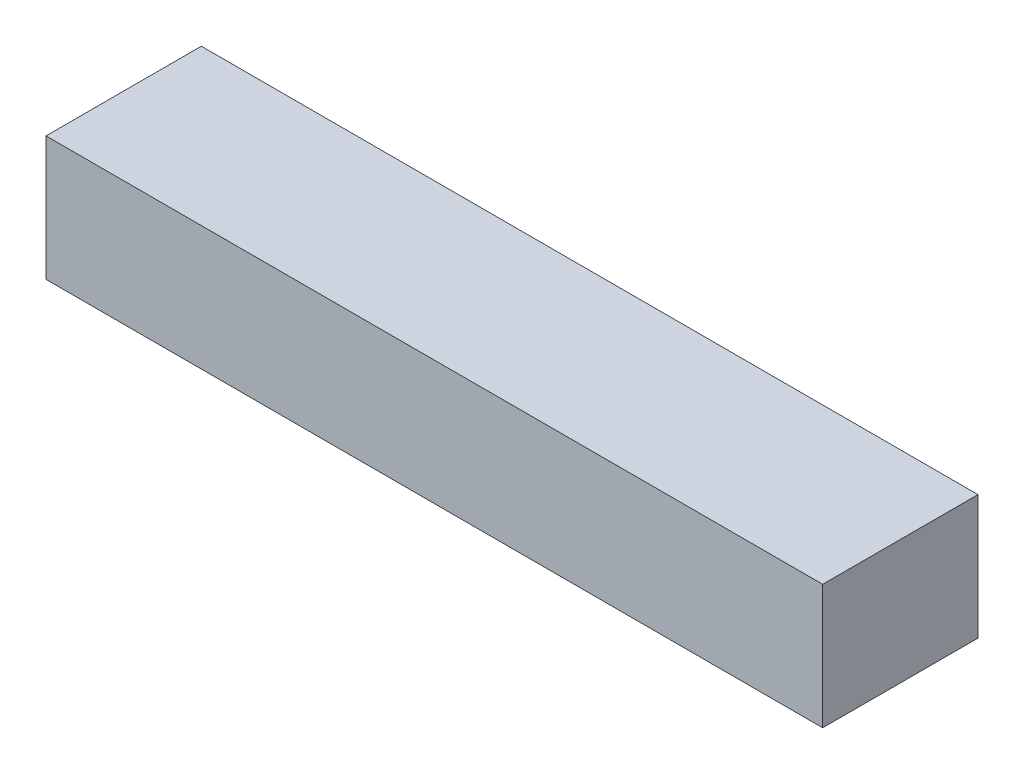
SolidWorks part; units mm, degrees
ref_plane "Front Plane" through (0, 0, 0) normal (0, 0, 1) x (1, 0, 0)
ref_plane "Top Plane" through (0, 0, 0) normal (0, 1, 0) x (1, 0, 0)
ref_plane "Right Plane" through (0, 0, 0) normal (1, 0, 0) x (0, 0, -1)
sketch "Sketch1" plane through (0, 0, 0) normal (0, 0, 1) x (1, 0, 0)
  line L1 (-25, 4) -> (25, 4)
  line L2 (-25, 4) -> (-25, -4)
  line L3 (-25, -4) -> (25, -4)
  line L4 (25, 4) -> (25, -4)
  line L5 (-25, 4) -> (25, -4) construction
  line L6 (-25, -4) -> (25, 4) construction
  point P0 (0, 0)
  dimension "D1" = 8
  dimension "D2" = 50
extrude "Boss-Extrude1" add sketch "Sketch1" along normal blind 10
